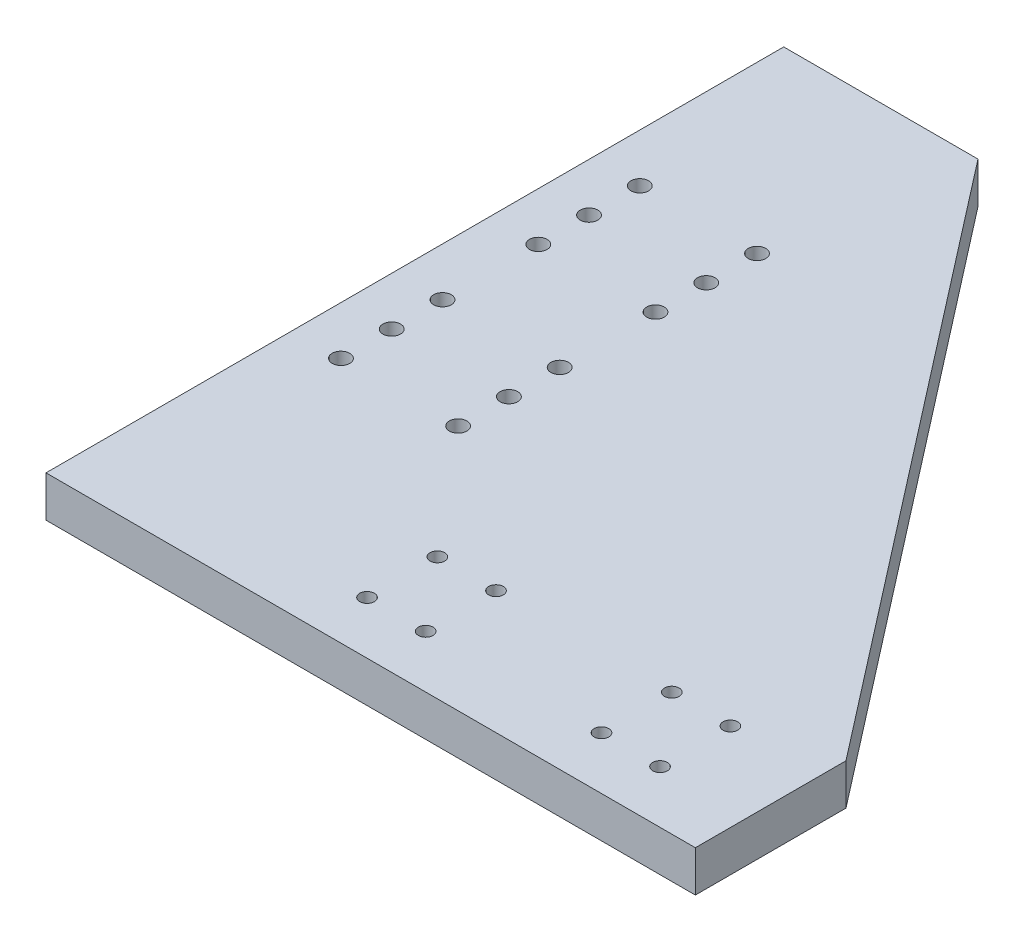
SolidWorks part; units mm, degrees
ref_plane "Front Plane" through (0, 0, 0) normal (1, 0, 0) x (0, 1, 0)
ref_plane "Top Plane" through (0, 0, 0) normal (0, 0, 1) x (0, 1, 0)
ref_plane "Right Plane" through (0, 0, 0) normal (0, 1, 0) x (-1, 0, 0)
sketch "sk w193" plane through (0, 0, 0) normal (0, 0, 1) x (0, 1, 0)
  point P0 (-399.034, -196.596)
  point P3 (-188.214, 0)
  line B0 (-399.034, -196.596) -> (-399.034, -160.02)
  line B1 (-399.034, -160.02) -> (-226.06, -160.02)
  line B2 (-210.82, -144.78) -> (-210.82, 144.78)
  line B3 (-226.06, 160.02) -> (-399.034, 160.02)
  line B4 (-399.034, 160.02) -> (-399.034, 196.596)
  line B5 (-399.034, 196.596) -> (0, 196.596)
  line B6 (0, 196.596) -> (0, 160.02)
  line B7 (0, 160.02) -> (-172.974, 160.02)
  line B8 (-188.214, 144.78) -> (-188.214, -144.78)
  line B9 (-172.974, -160.02) -> (0, -160.02)
  line B10 (0, -160.02) -> (0, -196.596)
  line B11 (0, -196.596) -> (-399.034, -196.596)
  arc B12 (-226.06, -160.02) -> (-210.82, -144.78) centre (-226.06, -144.78) ccw
  arc B13 (-210.82, 144.78) -> (-226.06, 160.02) centre (-226.06, 144.78) ccw
  arc B14 (-172.974, 160.02) -> (-188.214, 144.78) centre (-172.974, 144.78) ccw
  arc B15 (-188.214, -144.78) -> (-172.974, -160.02) centre (-172.974, -144.78) ccw
sketch_block_instance "w14x193-1-1"
sketch_block "w14x193-1" parameters "D4"=15.24, "D1"=399.034, "D2"=393.192, "D3"=22.606, "D5"=36.576
sketch "Sketch2" plane through (0, 0, 0) normal (0, 0, 1) x (0, 1, 0)
  line L0 (320, 501.4782) -> (320, -809.7231)
  line L1 (-188.214, 144.78) -> (-188.214, -144.78)
  line L2 (-188.214, -144.78) -> (-172.974, -160.02)
  line L3 (-172.974, -160.02) -> (5, -160.02)
  line L4 (-188.214, 144.78) -> (-172.974, 160.02)
  line L5 (-172.974, 160.02) -> (5, 160.02)
  line L6 (5, 201.596) -> (5, 160.02)
  line L7 (0, 196.596) -> (0, 160.02) construction
  line L8 (5, -160.02) -> (5, -201.596)
  line L9 (-285.82, 201.596) -> (5, 201.596)
  line L10 (-285.82, -201.596) -> (5, -201.596)
  line L11 (-285.82, 201.596) -> (-285.82, 239.696)
  line L12 (-285.82, 239.696) -> (167.6, 501.4782)
  line L13 (-285.82, -201.596) -> (-285.82, -239.696)
  line L14 (-285.82, -239.696) -> (167.6, -809.7231)
  line L15 (-210.82, -144.78) -> (-210.82, 144.78) construction
  line L16 (-399.034, 196.596) -> (0, 196.596) construction
  line L17 (0, -196.596) -> (-399.034, -196.596) construction
  line L18 (320, 501.4782) -> (167.6, 501.4782)
  line L19 (320, -809.7231) -> (167.6, -809.7231)
  point P30 (320, 501.4782)
  point P31 (320, -809.7231)
  dimension "D1" = 320
  dimension "D2" = 5
  dimension "D3" = 75
  dimension "D4" = 5
  dimension "D5" = 5
  dimension "D6" = 30
  dimension "D7" = 51.5
  dimension "D8" = 38.1
  dimension "D9" = 38.1
  dimension "D10" = 152.4
sketch "Sketch3" plane through (0, 0, 0) normal (0, 1, 0) x (-1, 0, 0)
  line L0 (-882.4965, 726.2511) -> (524.8782, 726.2511)
  line L1 (524.8782, 726.2511) -> (524.8782, -872.6489)
  line L2 (524.8782, -872.6489) -> (103.791, -872.6489)
  line L3 (103.791, -872.6489) -> (-882.4965, 399.797)
  line L4 (-882.4965, 399.797) -> (-882.4965, 726.2511)
  dimension "D1" = 524.8782
  dimension "D2" = 1598.9
  dimension "D3" = 882.4965
  dimension "D4" = 421.0872
  dimension "D5" = 326.4541
  dimension "D6" = 726.2511
extrude "Boss-Extrude1" add sketch "Sketch3" along normal blind 88.9
sketch "Sketch4" plane through (0, 0, 0) normal (0, 1, 0) x (-1, 0, 0)
  line L0 (-56.9965, 459.822) -> (-56.9965, 612.222) construction
  line L1 (166.116, -455.9739) -> (420.116, -455.9739) construction
  point P2 (-56.9965, 536.022)
  point P5 (293.116, -455.9739)
  circle B0 centre (-691.9965, 459.822) radius 15.875
  circle B1 centre (-691.9965, 612.222) radius 15.875
  circle B2 centre (-56.9965, 459.822) radius 15.875
  circle B3 centre (-56.9965, 612.222) radius 15.875
  circle B4 centre (-564.9965, 459.822) radius 15.875
  circle B5 centre (-564.9965, 612.222) radius 15.875
  circle B6 centre (-183.9965, 459.822) radius 15.875
  circle B7 centre (-183.9965, 612.222) radius 15.875
  circle B8 centre (-691.9965, 459.822) radius 34.925 construction
  circle B9 centre (-691.9965, 612.222) radius 34.925 construction
  circle B10 centre (166.116, 191.7261) radius 19.05
  circle B11 centre (420.116, 191.7261) radius 19.05
  circle B12 centre (166.116, -455.9739) radius 19.05
  circle B13 centre (420.116, -455.9739) radius 19.05
  circle B14 centre (166.116, 81.7261) radius 19.05
  circle B15 centre (420.116, 81.7261) radius 19.05
  circle B16 centre (166.116, -345.9739) radius 19.05
  circle B17 centre (420.116, -345.9739) radius 19.05
  circle B18 centre (166.116, 191.7261) radius 41.275 construction
  circle B19 centre (420.116, 191.7261) radius 41.275 construction
  circle B20 centre (166.116, -28.2739) radius 19.05
  circle B21 centre (420.116, -28.2739) radius 19.05
  circle B22 centre (166.116, -235.9739) radius 19.05
  circle B23 centre (420.116, -235.9739) radius 19.05
  circle B24 centre (166.116, 81.7261) radius 34.925 construction
  dimension "D1" = 455.9739
  dimension "D2" = 293.116
  dimension "D3" = 56.9965
  dimension "D4" = 536.022
sketch_block_instance "Block1-1"
sketch_block "Block1" parameters "D1"=31.75, "D2"=31.75, "D3"=31.75, "D4"=31.75, "D5"=69.85, "D6"=69.85
sketch_block_instance "Block2-1"
sketch_block "Block2" parameters "D1"=38.1, "D2"=38.1, "D3"=38.1, "D4"=38.1, "D5"=82.55, "D6"=82.55, "D7"=69.85
extrude "Cut-Extrude1" cut sketch "Sketch4" along normal through all
